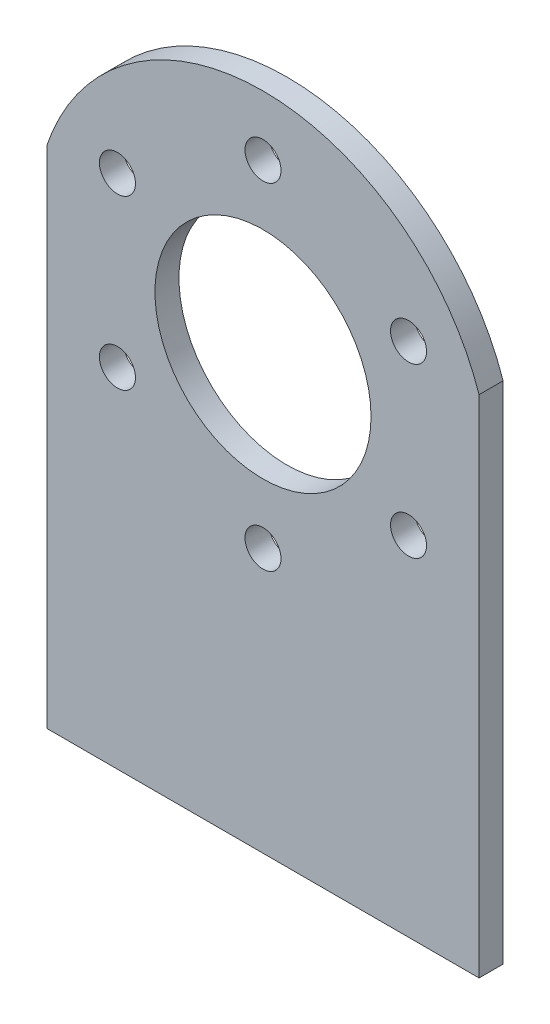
SolidWorks part; units mm, degrees
ref_plane "Front Plane" through (0, 0, 0) normal (0, 0, 1) x (1, 0, 0)
ref_plane "Top Plane" through (0, 0, 0) normal (0, 1, 0) x (1, 0, 0)
ref_plane "Right Plane" through (0, 0, 0) normal (1, 0, 0) x (0, 0, -1)
sketch "Sketch1" plane through (0, 0, 0) normal (0, 1, 0) x (1, 0, 0)
  line L0 (-57.15, 0) -> (57.15, 0)
  line L1 (57.15, 0) -> (57.15, 6.35)
  line L2 (57.15, 6.35) -> (-57.15, 6.35)
  line L3 (-57.15, 6.35) -> (-57.15, 0)
  point P3 (0, 0)
  dimension "D1" = 114.3
  dimension "D2" = 6.35
extrude "Boss-Extrude1" add sketch "Sketch1" along normal mid plane 174.625
sketch "Sketch4" plane through (0, 0, 0) normal (0, 0, 1) x (1, 0, 0)
  line L0 (-57.15, 87.3125) -> (-57.15, -87.3125) construction
  line L1 (57.15, 87.3125) -> (57.15, -87.3125) construction
  line L2 (-57.15, 87.3125) -> (57.15, 87.3125) construction
  line L3 (-57.15, 46.3003) -> (-57.15, 94.5499)
  line L4 (-57.15, 94.5499) -> (57.15, 94.5499)
  line L5 (57.15, 94.5499) -> (57.15, 46.3003)
  arc A0 (-57.15, 46.3003) -> (57.15, 46.3003) centre (0, 26.9875) cw
  point P3 (0, 87.3125)
  dimension "D1" = 60.325
  dimension "D2" = 48.2496
extrude "Cut-Extrude1" cut sketch "Sketch4" against normal through all
sketch "Sketch5" plane through (0, 0, 0) normal (0, 0, 1) x (1, 0, 0)
  circle A0 centre (0, 26.9875) radius 28.575
  dimension "D1" = 57.15
extrude "Cut-Extrude2" cut sketch "Sketch5" against normal through all
sketch "Sketch6" plane through (0, 0, 0) normal (0, 0, 1) x (1, 0, 0)
  circle A2 centre (0, 26.9875) radius 44.45 construction
  circle A3 centre (0, 71.4375) radius 4.7625
  circle A4 centre (38.4948, 49.2125) radius 4.7625
  circle A5 centre (38.4948, 4.7625) radius 4.7625
  circle A6 centre (0, -17.4625) radius 4.7625
  circle A7 centre (-38.4948, 4.7625) radius 4.7625
  circle A8 centre (-38.4948, 49.2125) radius 4.7625
  point P17 (0, 26.9875)
  dimension "D1" = 88.9
  dimension "D2" = 9.525
  dimension "D3" = 6
extrude "Cut-Extrude3" cut sketch "Sketch6" against normal through all
